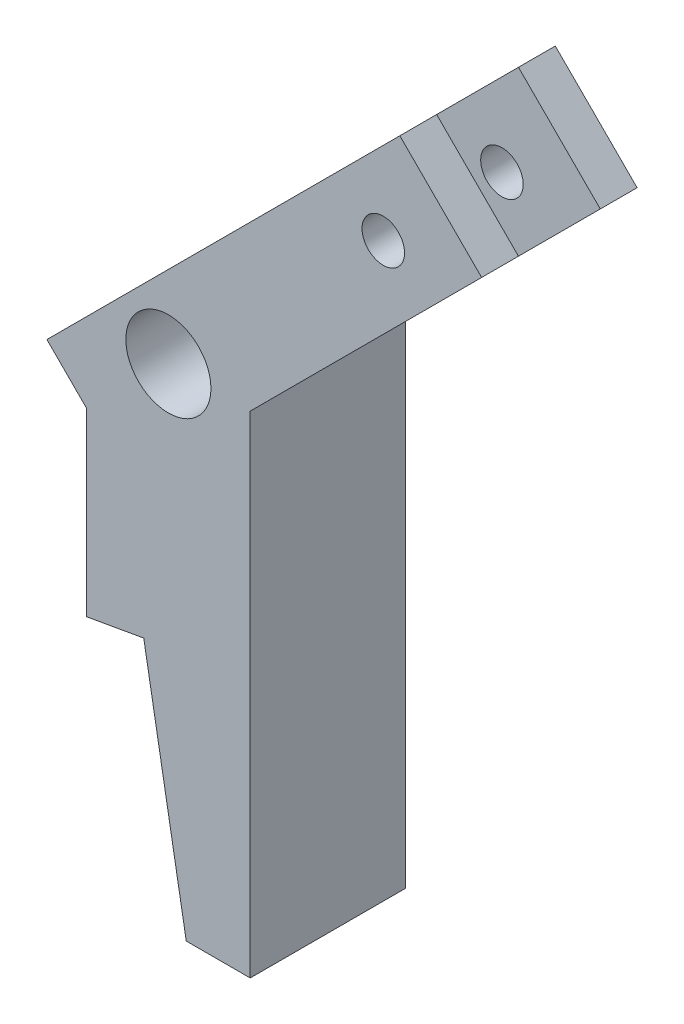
SolidWorks part; units mm, degrees
ref_plane "Ebene vorne" through (0, 0, 0) normal (0, 0, 1) x (1, 0, 0)
ref_plane "Ebene oben" through (0, 0, 0) normal (0, 1, 0) x (1, 0, 0)
ref_plane "Ebene rechts" through (0, 0, 0) normal (1, 0, 0) x (0, 0, -1)
sketch "Skizze1" plane through (0, 0, 0) normal (0, 0, 1) x (1, 0, 0)
  line L1 (-5, 15) -> (5, 15)
  line L2 (-5, 15) -> (-5, -15)
  line L3 (-5, -15) -> (5, -15)
  line L4 (5, 15) -> (5, -15)
  line L5 (-5, 15) -> (5, -15) construction
  line L6 (-5, -15) -> (5, 15) construction
  point P0 (0, 0)
  dimension "D1" = 10
  dimension "D2" = 30
extrude "Aufsatz-Linear austragen1" add sketch "Skizze1" along normal blind 9.5
ref_plane "Ebene1" through (10, 10, 0) normal (0.7071, 0.7071, 0) x (0, 0, -1)
sketch "Skizze2" plane through (10, 10, 0) normal (0.7071, 0.7071, 0) x (0, 0, -1)
  line L1 (-9.5, 7.0711) -> (0, 7.0711)
  line L2 (-9.5, 7.0711) -> (-9.5, 14.1421)
  line L3 (-9.5, 14.1421) -> (0, 14.1421)
  line L4 (0, 7.0711) -> (0, 14.1421)
extrude "Aufsatz-Linear austragen2" add sketch "Skizze2" along normal blind 20 and the other way blind 10.5
sketch "Skizze3" plane through (0, 0, 9.5) normal (0, 0, 1) x (1, 0, 0)
  line L0 (-5, -15) -> (5, -15) construction
  circle A0 centre (0, 15) radius 2.6
  dimension "D1" = 5.2
  dimension "D2" = 30
extrude "Schnitt-Linear austragen1" cut sketch "Skizze3" against normal blind 10
sketch "Skizze4" plane through (24.1421, 24.1421, 0) normal (0.7071, 0.7071, 0) x (0, 0, -1)
  line L0 (0, 7.0711) -> (0, 14.1421) construction
  line L1 (-7.25, 19.685) -> (-2.25, 19.685)
  line L2 (-7.25, 19.685) -> (-7.25, 4.4572)
  line L3 (-7.25, 4.4572) -> (-2.25, 4.4572)
  line L4 (-2.25, 19.685) -> (-2.25, 4.4572)
  line L5 (-7.25, 19.685) -> (-2.25, 4.4572) construction
  line L6 (-7.25, 4.4572) -> (-2.25, 19.685) construction
  line L7 (-9.5, 7.0711) -> (0, 7.0711) construction
  point P0 (-4.75, 12.0711)
  dimension "D1" = 5
  dimension "D2" = 4.75
  dimension "D3" = 5
extrude "Schnitt-Linear austragen2" cut sketch "Skizze4" against normal blind 10
sketch "Skizze5" plane through (0, 0, 0) normal (0, 0, -1) x (-1, 0, 0)
  line L0 (-19.1421, 29.1421) -> (-14.1421, 34.1421) construction
  line L1 (-5, 15) -> (-19.1421, 29.1421) construction
  circle A0 centre (-13.1317, 28.0815) radius 1.3
  dimension "D2" = 2.6
  dimension "D1" = 5
  dimension "D3" = 3.5
extrude "Schnitt-Linear austragen3" cut sketch "Skizze5" against normal blind 20
ref_plane "Ebene2" through (-7.4144, -1.3074, 0) normal (-0.9848, -0.1736, 0) x (0, 0, -1)
sketch "Skizze6" plane through (-7.4144, -1.3074, 0) normal (-0.9848, -0.1736, 0) x (0, 0, -1)
  line L1 (-9.5, 15) -> (0, 15)
  line L2 (-9.5, 15) -> (-9.5, 0)
  line L3 (-9.5, 0) -> (0, 0)
  line L4 (0, 15) -> (0, 0)
  dimension "D1" = 15
extrude "Schnitt-Linear austragen4" cut sketch "Skizze6" against normal blind 6
chamfer "Fase1" distance 3 angle 65 1 edges at (7.0711, 27.0711, 4.75)
